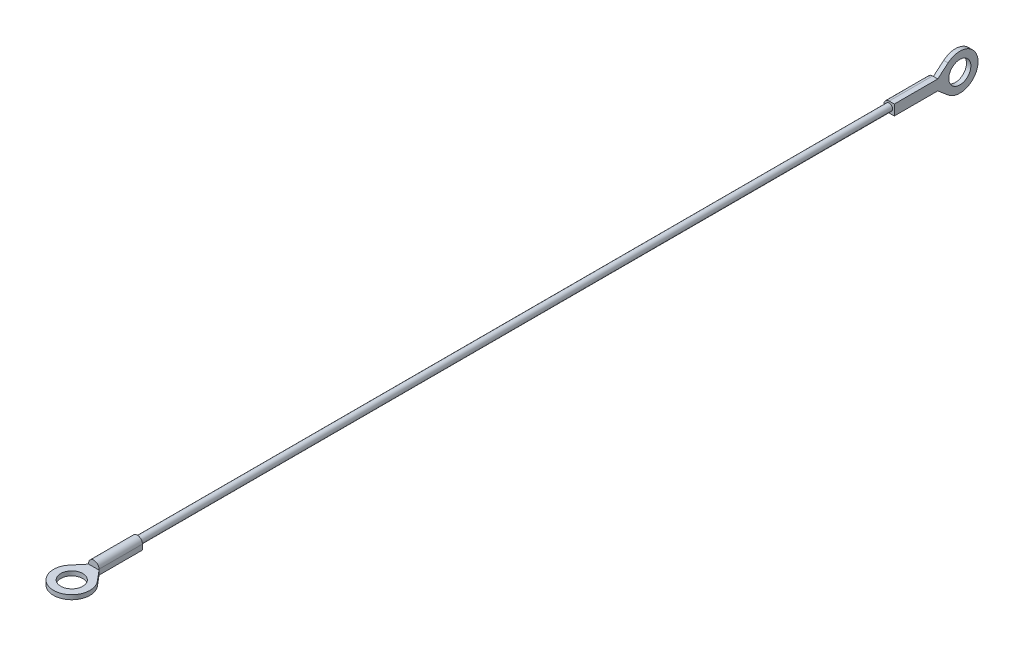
SolidWorks part; units mm, degrees
ref_plane "Front Plane" through (0, 0, 0) normal (0, 0, 1) x (1, 0, 0)
ref_plane "Top Plane" through (0, 0, 0) normal (0, 1, 0) x (1, 0, 0)
ref_plane "Right Plane" through (0, 0, 0) normal (1, 0, 0) x (0, 0, -1)
sketch "Sketch1" plane through (0, 0, 0) normal (0, 0, 1) x (1, 0, 0)
  circle A0 centre (0, 0) radius 0.795
extrude "Boss-Extrude1" add sketch "Sketch1" along normal mid plane 173.04
sketch "Sketch2" plane through (0, 0, 86.52) normal (0, 0, 1) x (1, 0, 0)
  line L0 (-1.195, 0) -> (-1.195, -1.195)
  line L1 (-1.195, -1.195) -> (0, -1.195)
  line L2 (0, -1.195) -> (1.195, -1.195)
  line L3 (1.195, -1.195) -> (1.195, 0)
  arc A0 (1.195, 0) -> (-1.195, 0) centre (0, 0) ccw
  dimension "D1" = 2.39
extrude "Boss-Extrude2" add sketch "Sketch2" along normal blind 10
sketch "Sketch3" plane through (0, -1.195, 0) normal (0, -1, 0) x (1, 0, 0)
  line L0 (1.195, 96.52) -> (3.2017, 98.8972)
  line L1 (-3.2017, 98.8972) -> (-1.195, 96.52)
  line L2 (-1.195, 96.52) -> (1.195, 96.52)
  arc A0 (3.2017, 98.8972) -> (-3.2017, 98.8972) centre (0, 101.6) ccw
  circle A1 centre (0, 101.6) radius 2.54
  point P8 (4.19, 101.6)
  point P9 (-4.19, 101.6)
  dimension "D1" = 5.08
  dimension "D2" = 8.38
  dimension "D3" = 101.6
extrude "Boss-Extrude3" add sketch "Sketch3" against normal blind 1.01
sketch "Sketch4" plane through (0, 0, -86.52) normal (0, 0, -1) x (-1, 0, 0)
  line L0 (0, 1.195) -> (-1.195, 1.195)
  line L1 (-1.195, 1.195) -> (-1.195, 0)
  line L2 (-1.195, 0) -> (-1.195, -1.195)
  line L3 (-1.195, -1.195) -> (0, -1.195)
  arc A0 (0, -1.195) -> (0, 1.195) centre (0, 0) ccw
  dimension "D1" = 2.39
extrude "Boss-Extrude4" add sketch "Sketch4" along normal blind 10
sketch "Sketch5" plane through (1.195, 0, 0) normal (1, 0, 0) x (0, 0, -1)
  line L0 (96.52, -1.195) -> (96.52, 1.195)
  line L1 (96.52, 1.195) -> (98.8972, 3.2017)
  line L2 (98.8972, -3.2017) -> (96.52, -1.195)
  arc A0 (98.8972, 3.2017) -> (98.8972, -3.2017) centre (101.6, 0) cw
  circle A1 centre (101.6, 0) radius 2.54
  point P8 (101.6, 4.19)
  point P9 (101.6, -4.19)
  dimension "D1" = 5.08
  dimension "D2" = 8.38
  dimension "D3" = 101.6
extrude "Boss-Extrude5" add sketch "Sketch5" against normal blind 1.01
